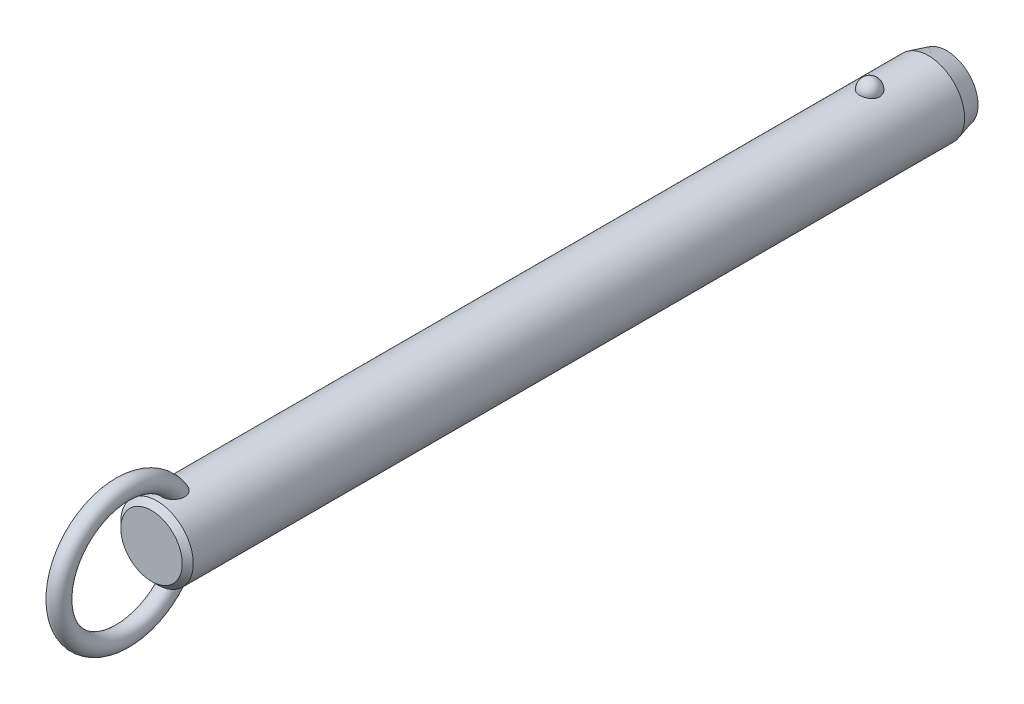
SolidWorks part; units mm, degrees
ref_plane "Front Plane" through (0, 0, 0) normal (0, 0, 1) x (1, 0, 0)
ref_plane "Top Plane" through (0, 0, 0) normal (0, 1, 0) x (1, 0, 0)
ref_plane "Right Plane" through (0, 0, 0) normal (1, 0, 0) x (0, 0, -1)
sketch "Sketch2" plane through (0, 0, 0) normal (0, 0, 1) x (1, 0, 0)
  circle A0 centre (0, 0) radius 7.9
  point P3 (0, 7.9)
  dimension "D1" = 15.8
extrude "Boss-Extrude1" add sketch "Sketch2" along normal blind 144.8
sketch "Sketch3" plane through (0, 0, 0) normal (0, 0, -1) x (-1, 0, 0)
  circle A0 centre (0, 0) radius 7.9
  dimension "D1" = 15.8
extrude "Boss-Extrude2" add sketch "Sketch3" along normal blind 19
chamfer "Chamfer1" distance 4 angle 15 1 edges at (-7.9, 0, -19)
sketch "Sketch12" plane through (0, 0, 0) normal (1, 0, 0) x (0, 0, -1)
  line L0 (-144.8, 7.9) -> (-144.8, -7.9) construction
  point P0 (-144.8, 0)
sketch "Sketch13" plane through (0, 0, 0) normal (1, 0, 0) x (0, 0, -1)
  circle A0 centre (-160.65, 0) radius 15.85
  point P2 (-144.8, 0)
  dimension "D1" = 31.7
sketch "Sketch14" plane through (0, 0, 0) normal (0, 1, 0) x (1, 0, 0)
  circle A0 centre (0, -146.8) radius 2
  point P2 (0, -144.8)
  dimension "D1" = 4
sweep "Sweep1" add profiles "Sketch14" path "Sketch13"
sketch "Sketch15" plane through (0, 0, 144.8) normal (0, 0, 1) x (1, 0, 0)
  circle A0 centre (0, 0) radius 7.9
  dimension "D1" = 15.8
extrude "Boss-Extrude3" add sketch "Sketch15" along normal blind 9.52
chamfer "Chamfer2" distance 1.2 angle 45 1 edges at (7.9, 0, 154.32)
sketch "Sketch18" plane through (0, 0, 0) normal (1, 0, 0) x (0, 0, -1)
  line L0 (15, 7.9) -> (-146.9091, 7.9) construction
  line L1 (2.2, 10.1) -> (2.2, 5.7)
  line L2 (-146.9091, -7.9) -> (15, -7.9) construction
  arc A0 (2.2, 10.1) -> (2.2, 5.7) centre (2.2, 7.9) ccw
  point P4 (0, 7.9)
  dimension "D1" = 18
revolve "Revolve1" add sketch "Sketch18" angle 360 about L1
